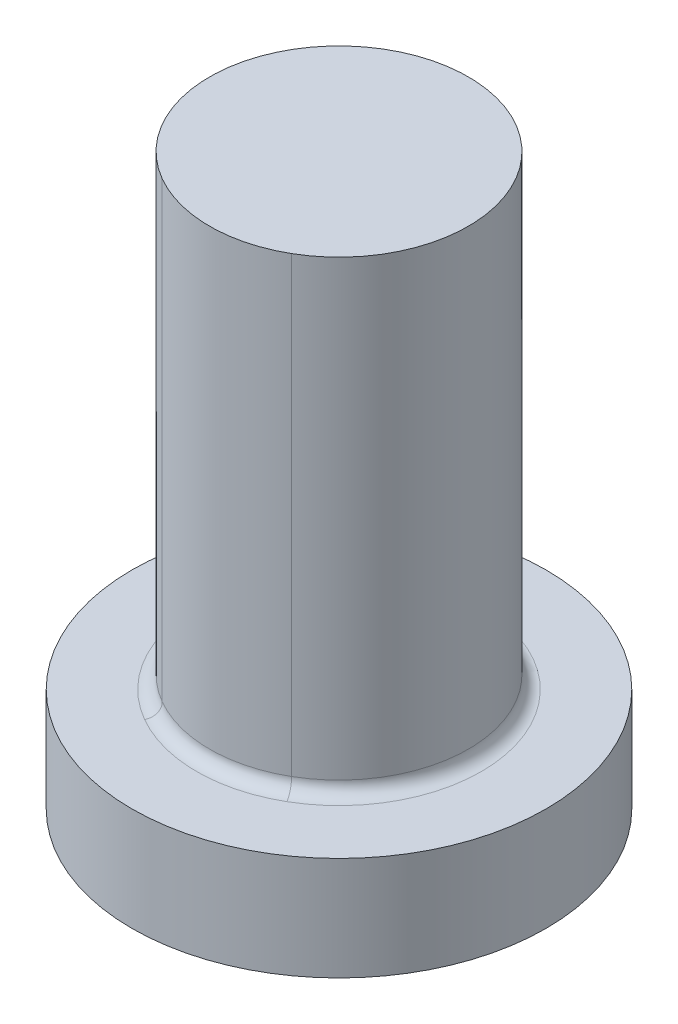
SolidWorks part; units mm, degrees
ref_plane "Plan de face" through (0, 0, 0) normal (0, 0, 1) x (1, 0, 0)
ref_plane "Plan de dessus" through (0, 0, 0) normal (0, 1, 0) x (1, 0, 0)
ref_plane "Plan de droite" through (0, 0, 0) normal (1, 0, 0) x (0, 0, -1)
sketch "Esquisse1" plane through (0, 0, 0) normal (0, 0, 1) x (1, 0, 0)
  line L0 (0, 0) -> (8, 0)
  line L1 (8, 0) -> (8, 4)
  line L2 (8, 4) -> (5, 4)
  line L3 (5, 4) -> (5, 22)
  line L4 (5, 22) -> (0, 22)
  line L5 (0, 22) -> (0, 0)
  line L6 (0, 0) -> (0, 24.637) construction
  dimension "D1" = 8
  dimension "D2" = 5
  dimension "D3" = 4
  dimension "D4" = 22
revolve "Révolution1" add sketch "Esquisse1" angle 360 about L6
sketch "Esquisse2" plane through (0, 22, 0) normal (0, 1, 0) x (-1, 0, 0)
  line L0 (0, 0) -> (4.9269, 8.5337) construction
  line L1 (0, 0) -> (-5.5422, 9.5993) construction
  line L2 (-9.1995, 0) -> (9.1061, 0) construction
  line L3 (0, 0) -> (-3.9877, 6.9069)
  line L4 (0, 0) -> (3.9877, 6.9069)
  dimension "D1" = 60
  dimension "D2" = 60
fillet "Congé1" radius 0.5 2 edges at (0, 4, -5) (0, 4, 5)
